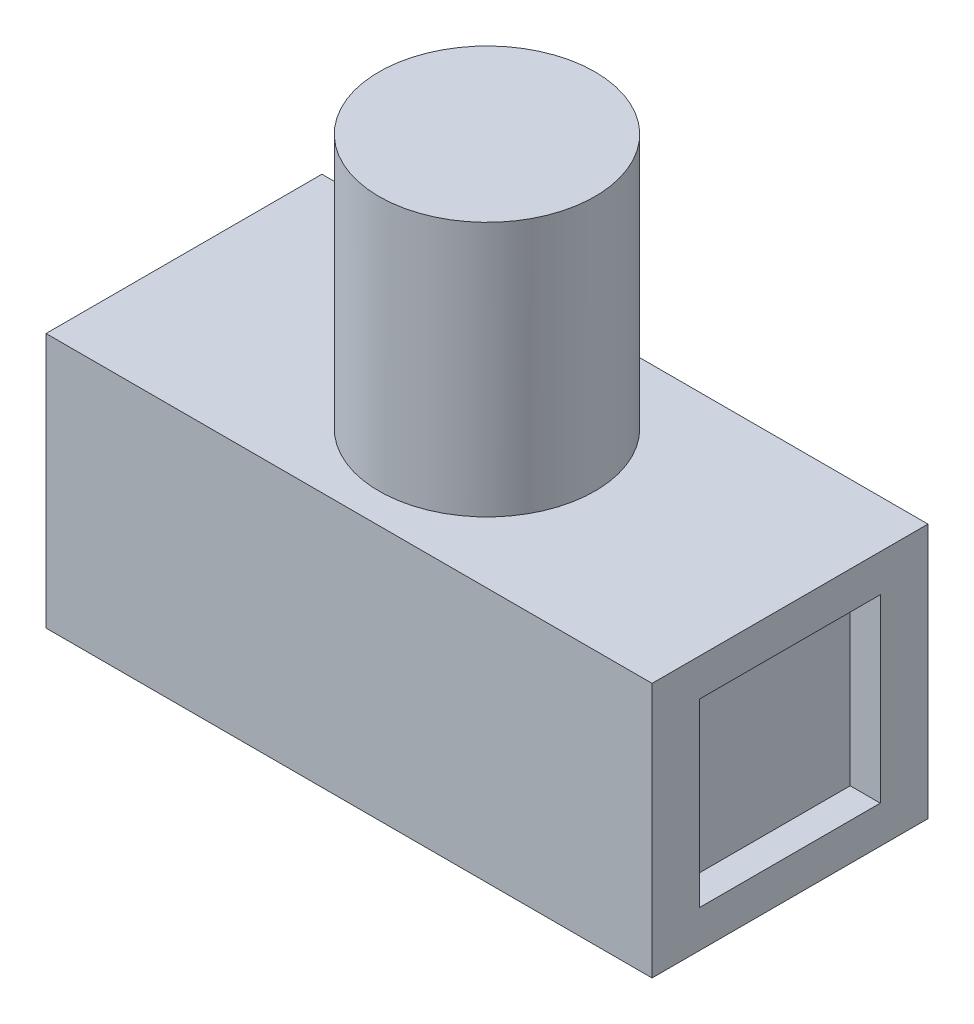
SolidWorks part; units mm, degrees
ref_plane "Front Plane" through (0, 0, 0) normal (0, 0, 1) x (1, 0, 0)
ref_plane "Top Plane" through (0, 0, 0) normal (0, 1, 0) x (1, 0, 0)
ref_plane "Right Plane" through (0, 0, 0) normal (1, 0, 0) x (0, 0, -1)
sketch "Sketch1" plane through (0, 0, 0) normal (0, 1, 0) x (1, 0, 0)
  line L0 (-63.9483, -29.1126) -> (63.9483, -29.1126)
  line L1 (-63.9483, -29.1126) -> (-63.9483, 29.1126)
  line L2 (63.9483, -29.1126) -> (63.9483, 29.1126)
  line L3 (-63.9483, 29.1126) -> (63.9483, 29.1126)
  line L4 (-63.9483, -29.1126) -> (63.9483, 29.1126) construction
  line L5 (63.9483, -29.1126) -> (-63.9483, 29.1126) construction
  point P1 (0, 0)
extrude "Boss-Extrude1" add sketch "Sketch1" along normal blind 53.848
sketch "Sketch2" plane through (0, 53.848, 0) normal (0, 1, 0) x (1, 0, 0)
  circle A0 centre (0, 0) radius 22.7945
extrude "Boss-Extrude2" add sketch "Sketch2" along normal blind 53.848
sketch "Sketch3" plane through (63.9483, 0, 0) normal (1, 0, 0) x (0, 0, -1)
  line L0 (-29.1126, 53.848) -> (29.1126, 0) construction
  line L1 (-19.05, 45.974) -> (19.05, 45.974)
  line L2 (-19.05, 45.974) -> (-19.05, 7.874)
  line L3 (-19.05, 7.874) -> (19.05, 7.874)
  line L4 (19.05, 45.974) -> (19.05, 7.874)
  line L5 (-19.05, 7.874) -> (19.05, 45.974) construction
  point P8 (0, 26.924)
  dimension "D1" = 38.1
extrude "Cut-Extrude1" cut sketch "Sketch3" against normal blind 6.35
